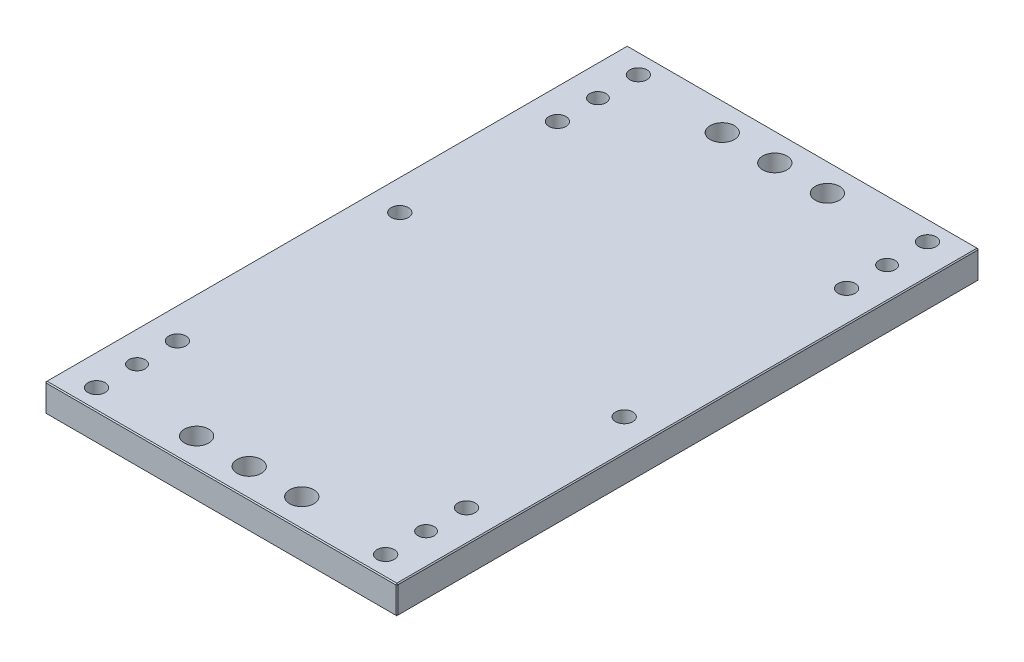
SolidWorks part; units mm, degrees
ref_plane "Plane1" through (0, 0, 0) normal (0, 0, 1) x (1, 0, 0)
ref_plane "Plane2" through (0, 0, 0) normal (0, 1, 0) x (1, 0, 0)
ref_plane "Plane3" through (0, 0, 0) normal (1, 0, 0) x (0, 0, -1)
sketch "Sketch1" plane through (0, 0, 0) normal (0, 0, 1) x (1, 0, 0)
  line L0 (-138.1125, 0) -> (138.1125, 0)
  line L1 (-138.1125, 0) -> (-138.1125, 22.225)
  line L2 (138.1125, 22.225) -> (-138.1125, 22.225)
  line L3 (138.1125, 22.225) -> (138.1125, 0)
extrude "Base-Extrude" add sketch "Sketch1" along normal mid plane 457.2
hole_wizard "1/2 Dowel Hole1" positions "12DH1ctrl" profile "12DH1rev"
sketch "12DH1ctrl" plane through (0, 0, 0) normal (0, -1, 0) x (1, 0, 0)
  point P0 (-113.5062, 180.975)
sketch "12DH1rev" plane through (-113.5062, 0, 180.975) normal (1, 0, 0) x (0, 0, -1)
  line L0 (0, 0) -> (0, 22.226)
  line L1 (0, 22.226) -> (6.35, 22.226)
  line L2 (6.35, 22.2235) -> (6.35, 0.0025)
  line L3 (6.35, 0.0025) -> (6.35, 0)
  line L5 (6.35, 0) -> (0, 0)
  line L6 (-6.35, 0.0025) -> (-6.35, 0) construction
  line L7 (6.35, 22.226) -> (6.35, 22.2235)
  line L8 (-6.35, 22.226) -> (-6.35, 22.2235) construction
  line L11 (0, -6.35) -> (0, 107.95) construction
hole_wizard "1/2 Dowel Hole2" positions "12DH2ctrl" profile "12DH2rev" legacy
sketch "12DH2ctrl" plane through (0, 0, 0) normal (0, -1, 0) x (1, 0, 0)
  point P0 (-113.5063, -180.975)
sketch "12DH2rev" plane through (-113.5063, 0, -180.975) normal (1, 0, 0) x (0, 0, -1)
  line L0 (0, 0) -> (0, 22.226)
  line L1 (0, 22.226) -> (6.35, 22.226)
  line L2 (6.35, 22.2235) -> (6.35, 0.0025)
  line L3 (6.35, 0.0025) -> (6.35, 0)
  line L5 (6.35, 0) -> (0, 0)
  line L6 (-6.35, 0.0025) -> (-6.35, 0) construction
  line L7 (6.35, 22.226) -> (6.35, 22.2235)
  line L8 (-6.35, 22.226) -> (-6.35, 22.2235) construction
  line L11 (0, -6.35) -> (0, 107.95) construction
chamfer "Edge Break" distance 0.7937 angle 45 12 edges at (138.1125, 11.1125, 228.6) (0, 0, 228.6) (-138.1125, 11.1125, 228.6) (0, 0, -228.6) (138.1125, 11.1125, -228.6) (0, 22.225, -228.6) (-138.1125, 11.1125, -228.6) (0, 22.225, 228.6) (-138.1125, 0, 0) (138.1125, 0, 0) (138.1125, 22.225, 0) (-138.1125, 22.225, 0)
hole_wizard "CBore1" positions "CBore1ctrl" profile "CBore1rev" legacy
sketch "CBore1ctrl" plane through (0, 0, 0) normal (0, -1, 0) x (1, 0, 0)
  line L0 (0, -50) -> (0, 50) construction
  line L1 (50, 0) -> (-50, 0) construction
  point P0 (-113.5063, -212.725)
sketch "CBore1rev" plane through (-113.5063, 0, -212.725) normal (1, 0, 0) x (0, 0, -1)
  line L0 (0, 0) -> (0, 22.226)
  line L1 (6.7462, 22.2235) -> (6.7462, 22.226)
  line L2 (6.7462, 22.2235) -> (6.7462, 12.7025)
  line L3 (6.7462, 12.7025) -> (6.7462, 12.7)
  line L4 (6.7462, 12.7) -> (10.3187, 12.7)
  line L5 (10.3187, 12.7) -> (10.3187, 0.0025)
  line L6 (10.3187, 0.0025) -> (10.3187, 0)
  line L7 (10.3187, 0) -> (0, 0)
  line L8 (-10.3187, 0.0025) -> (-10.3187, 0) construction
  line L9 (-6.7462, 12.7025) -> (-6.7462, 12.7) construction
  line L11 (0, -6.35) -> (0, 107.95) construction
  line L12 (6.7462, 22.226) -> (0, 22.226)
  line L13 (-6.7462, 22.2235) -> (-6.7462, 22.226) construction
hole_wizard "CBore2" positions "CBore2ctrl" profile "CBore2rev" legacy
sketch "CBore2ctrl" plane through (0, 0, 0) normal (0, -1, 0) x (1, 0, 0)
  line L0 (50, 0) -> (-50, 0) construction
  line L1 (0, -50) -> (0, 50) construction
  point P0 (-113.5063, 212.725)
sketch "CBore2rev" plane through (-113.5063, 0, 212.725) normal (1, 0, 0) x (0, 0, -1)
  line L0 (0, 0) -> (0, 22.226)
  line L1 (6.7462, 22.2235) -> (6.7462, 22.226)
  line L2 (6.7462, 22.2235) -> (6.7462, 12.7025)
  line L3 (6.7462, 12.7025) -> (6.7462, 12.7)
  line L4 (6.7462, 12.7) -> (10.3187, 12.7)
  line L5 (10.3187, 12.7) -> (10.3187, 0.0025)
  line L6 (10.3187, 0.0025) -> (10.3187, 0)
  line L7 (10.3187, 0) -> (0, 0)
  line L8 (-10.3187, 0.0025) -> (-10.3187, 0) construction
  line L9 (-6.7462, 12.7025) -> (-6.7462, 12.7) construction
  line L11 (0, -6.35) -> (0, 107.95) construction
  line L12 (6.7462, 22.226) -> (0, 22.226)
  line L13 (-6.7462, 22.2235) -> (-6.7462, 22.226) construction
hole_wizard "CBore3" positions "CBore3ctrl" profile "CBore3rev" legacy
sketch "CBore3ctrl" plane through (0, 0, 0) normal (0, -1, 0) x (1, 0, 0)
  line L0 (50, 0) -> (-50, 0) construction
  line L1 (0, -50) -> (0, 50) construction
  point P0 (-113.5063, -149.225)
sketch "CBore3rev" plane through (-113.5063, 0, -149.225) normal (1, 0, 0) x (0, 0, -1)
  line L0 (0, 0) -> (0, 22.226)
  line L1 (6.7462, 22.2235) -> (6.7462, 22.226)
  line L2 (6.7462, 22.2235) -> (6.7462, 12.7025)
  line L3 (6.7462, 12.7025) -> (6.7462, 12.7)
  line L4 (6.7462, 12.7) -> (10.3187, 12.7)
  line L5 (10.3187, 12.7) -> (10.3187, 0.0025)
  line L6 (10.3187, 0.0025) -> (10.3187, 0)
  line L7 (10.3187, 0) -> (0, 0)
  line L8 (-10.3187, 0.0025) -> (-10.3187, 0) construction
  line L9 (-6.7462, 12.7025) -> (-6.7462, 12.7) construction
  line L11 (0, -6.35) -> (0, 107.95) construction
  line L12 (6.7462, 22.226) -> (0, 22.226)
  line L13 (-6.7462, 22.2235) -> (-6.7462, 22.226) construction
hole_wizard "CBore4" positions "CBore4ctrl" profile "CBore4rev" legacy
sketch "CBore4ctrl" plane through (0, 0, 0) normal (0, -1, 0) x (1, 0, 0)
  line L0 (50, 0) -> (-50, 0) construction
  line L1 (0, -50) -> (0, 50) construction
  point P0 (-113.5063, 149.225)
sketch "CBore4rev" plane through (-113.5063, 0, 149.225) normal (1, 0, 0) x (0, 0, -1)
  line L0 (0, 0) -> (0, 22.226)
  line L1 (6.7462, 22.2235) -> (6.7462, 22.226)
  line L2 (6.7462, 22.2235) -> (6.7462, 12.7025)
  line L3 (6.7462, 12.7025) -> (6.7462, 12.7)
  line L4 (6.7462, 12.7) -> (10.3187, 12.7)
  line L5 (10.3187, 12.7) -> (10.3187, 0.0025)
  line L6 (10.3187, 0.0025) -> (10.3187, 0)
  line L7 (10.3187, 0) -> (0, 0)
  line L8 (-10.3187, 0.0025) -> (-10.3187, 0) construction
  line L9 (-6.7462, 12.7025) -> (-6.7462, 12.7) construction
  line L11 (0, -6.35) -> (0, 107.95) construction
  line L12 (6.7462, 22.226) -> (0, 22.226)
  line L13 (-6.7462, 22.2235) -> (-6.7462, 22.226) construction
hole_wizard "CBore5" positions "CBore5ctrl" profile "CBore5rev" legacy
sketch "CBore5ctrl" plane through (0, 0, 0) normal (0, -1, 0) x (1, 0, 0)
  line L1 (0, -50) -> (0, 50) construction
  point P0 (-113.5063, -25.4)
sketch "CBore5rev" plane through (-113.5063, 0, -25.4) normal (1, 0, 0) x (0, 0, -1)
  line L0 (0, 0) -> (0, 22.225)
  line L1 (6.7462, 22.2225) -> (6.7462, 22.225)
  line L2 (6.7462, 22.2225) -> (6.7462, 12.7025)
  line L3 (6.7462, 12.7025) -> (6.7462, 12.7)
  line L4 (6.7462, 12.7) -> (10.3187, 12.7)
  line L5 (10.3187, 12.7) -> (10.3187, 0.0025)
  line L6 (10.3187, 0.0025) -> (10.3187, 0)
  line L7 (10.3187, 0) -> (0, 0)
  line L8 (-10.3187, 0.0025) -> (-10.3187, 0) construction
  line L9 (-6.7462, 12.7025) -> (-6.7462, 12.7) construction
  line L11 (0, -6.35) -> (0, 107.95) construction
  line L12 (6.7462, 22.225) -> (0, 22.225)
  line L13 (-6.7462, 22.2225) -> (-6.7462, 22.225) construction
mirror "Mirror1" about plane through (0, 0, 0) normal (1, 0, 0) of "CBore4", "CBore3", "CBore2", "CBore1", "1/2 Dowel Hole2", "1/2 Dowel Hole1"
hole_wizard "CBore6" positions "CBore6ctrl" profile "CBore6rev" legacy
sketch "CBore6ctrl" plane through (254.0541, 0, -183.9683) normal (0, -1, 0) x (1, 0, 0)
  line L2 (-254.0541, 133.9683) -> (-254.0541, 233.9683) construction
  point P0 (-140.5478, 209.3683)
sketch "CBore6rev" plane through (113.5063, 0, 25.4) normal (1, 0, 0) x (0, 0, -1)
  line L0 (0, 0) -> (0, 22.225)
  line L1 (6.7462, 22.2225) -> (6.7462, 22.225)
  line L2 (6.7462, 22.2225) -> (6.7462, 12.7025)
  line L3 (6.7462, 12.7025) -> (6.7462, 12.7)
  line L4 (6.7462, 12.7) -> (10.3187, 12.7)
  line L5 (10.3187, 12.7) -> (10.3187, 0.0025)
  line L6 (10.3187, 0.0025) -> (10.3187, 0)
  line L7 (10.3187, 0) -> (0, 0)
  line L8 (-10.3187, 0.0025) -> (-10.3187, 0) construction
  line L9 (-6.7462, 12.7025) -> (-6.7462, 12.7) construction
  line L11 (0, -6.35) -> (0, 107.95) construction
  line L12 (6.7462, 22.225) -> (0, 22.225)
  line L13 (-6.7462, 22.2225) -> (-6.7462, 22.225) construction
other "Guide1"
sketch "Eject1" plane through (0, 0, 0) normal (0, -1, 0) x (1, 0, 0)
  circle A0 centre (-41.275, -206.375) radius 9.525
sketch "Eject2" plane through (-11.407, 0, 719.7003) normal (0, -1, 0) x (1, 0, 0)
  circle A0 centre (-29.868, -513.3253) radius 9.525
other "Guide2"
sketch "Eject3" plane through (126.04, 0, 718.2078) normal (0, -1, 0) x (1, 0, 0)
  circle A0 centre (-84.765, -511.8328) radius 9.525
other "Guide3"
sketch "Eject4" plane through (129.6175, 0, -1.8667) normal (0, -1, 0) x (1, 0, 0)
  circle A0 centre (-88.3425, -204.5083) radius 9.525
other "Guide4"
sketch "Eject5" plane through (55.4134, 0, -1.3825) normal (0, -1, 0) x (1, 0, 0)
  line L0 (-55.4134, -48.6175) -> (-55.4134, 51.3825) construction
  circle A0 centre (-55.4134, -204.9925) radius 9.525
other "Guide5"
sketch "Eject6" plane through (48.0969, 0, 722.5446) normal (0, -1, 0) x (1, 0, 0)
  line L0 (-48.0969, -772.5446) -> (-48.0969, -672.5446) construction
  circle A0 centre (-48.0969, -516.1696) radius 9.525
other "Guide6"
other "Gbore1"
sketch "Sketch8" plane through (0, 0, 0) normal (0, -1, 0) x (1, 0, 0)
  circle A0 centre (-41.275, -206.375) radius 12.573
  circle A1 centre (-41.275, -206.375) radius 9.525 construction
sketch "Sketch9" plane through (-3.2591, 0, 672.8913) normal (0, -1, 0) x (1, 0, 0)
  circle A0 centre (-38.0159, -466.5163) radius 12.573
  circle A1 centre (-38.0159, -466.5163) radius 9.525 construction
other "Gbore2"
sketch "Sketch10" plane through (146.7383, 0, 670.6858) normal (0, -1, 0) x (1, 0, 0)
  circle A0 centre (-105.4633, -464.3108) radius 12.573
  circle A1 centre (-105.4633, -464.3108) radius 9.525 construction
other "Gbore3"
sketch "Sketch11" plane through (147.7649, 0, -3.3578) normal (0, -1, 0) x (1, 0, 0)
  circle A0 centre (-106.4899, -203.0172) radius 12.573
  circle A1 centre (-106.4899, -203.0172) radius 9.525 construction
other "Gbore4"
sketch "Sketch12" plane through (69.9123, 0, -5.204) normal (0, -1, 0) x (1, 0, 0)
  circle A0 centre (-69.9123, -201.171) radius 12.573
  circle A1 centre (-69.9123, -201.171) radius 9.525 construction
other "Gbore5"
sketch "Sketch13" plane through (70.0822, 0, 675.4595) normal (0, -1, 0) x (1, 0, 0)
  circle A0 centre (-70.0822, -469.0845) radius 12.573
  circle A1 centre (-70.0822, -469.0845) radius 9.525 construction
other "Gbore6"
equation "\"halfW@Sketch1\" = \"W@Sketch1\" / 2"
